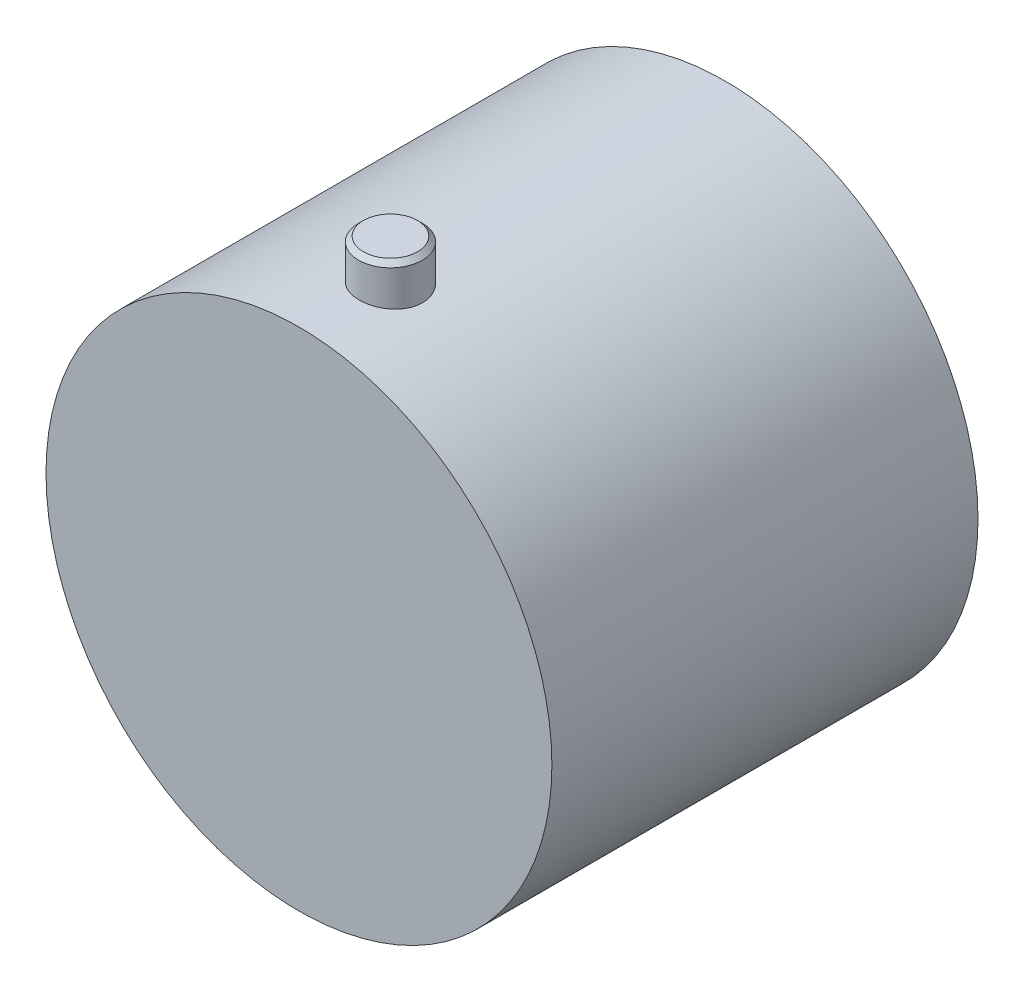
SolidWorks part; units mm, degrees
ref_plane "Front Plane" through (0, 0, 0) normal (0, 0, 1) x (1, 0, 0)
ref_plane "Top Plane" through (0, 0, 0) normal (0, 1, 0) x (1, 0, 0)
ref_plane "Right Plane" through (0, 0, 0) normal (1, 0, 0) x (0, 0, -1)
sketch "Sketch1" plane through (0, 0, 0) normal (0, 0, 1) x (1, 0, 0)
  circle A0 centre (0, 0) radius 26
extrude "Extrude1" add sketch "Sketch1" along normal blind 43.8
sketch "Sketch2" plane through (0, 0, 0) normal (0, 1, 0) x (1, 0, 0)
  circle A0 centre (0.62, -35.0121) radius 3.2858
extrude "Extrude2" add sketch "Sketch2" along normal blind 30
chamfer "Chamfer1" distance 0.5 angle 45 1 edges at (0.62, 30, 38.2979)
